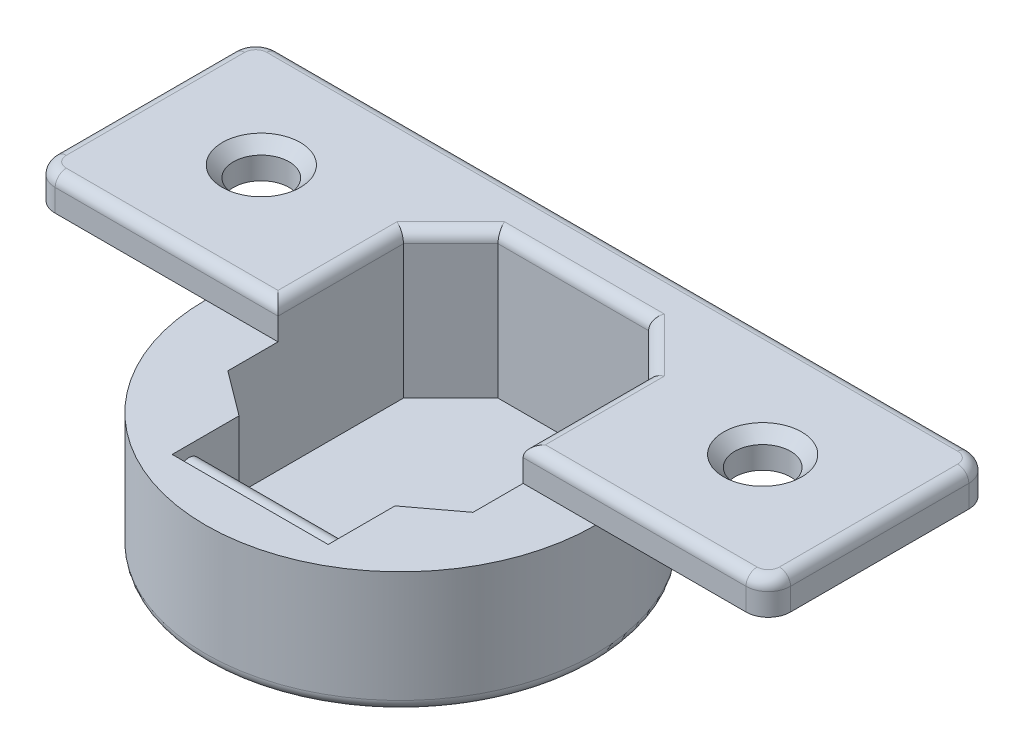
SolidWorks part; units mm, degrees
ref_plane "Vorne" through (0, 0, 0) normal (0, 0, 1) x (1, 0, 0)
ref_plane "Oben" through (0, 0, 0) normal (0, 1, 0) x (1, 0, 0)
ref_plane "Rechts" through (0, 0, 0) normal (1, 0, 0) x (0, 0, -1)
sketch "Skizze1" plane through (0, 0, 0) normal (0, 1, 0) x (1, 0, 0)
  circle A0 centre (0, 0) radius 17.5
  dimension "D1" = 35
extrude "Linear austragen1" add sketch "Skizze1" along normal blind 11
sketch "Skizze2" plane through (0, 11, 0) normal (0, 1, 0) x (1, 0, 0)
  line L1 (31, 20) -> (-31, 20)
  line L2 (33, 18) -> (33, 2)
  line L3 (31, 0) -> (-31, 0)
  line L4 (-33, 18) -> (-33, 2)
  line L5 (33, 20) -> (-33, 0) construction
  line L6 (33, 0) -> (-33, 20) construction
  arc A0 (31, 20) -> (33, 18) centre (31, 18) cw
  arc A1 (33, 2) -> (31, 0) centre (31, 2) cw
  arc A2 (-31, 0) -> (-33, 2) centre (-31, 2) cw
  arc A3 (-31, 20) -> (-33, 18) centre (-31, 18) ccw
  point P0 (0, 10)
  dimension "D3" = 2
  dimension "D1" = 66
  dimension "D2" = 20
extrude "Linear austragen2" add sketch "Skizze2" along normal blind 3
sketch "Skizze3" plane through (0, 14, 0) normal (0, 1, 0) x (1, 0, 0)
  line L0 (0, 25.9125) -> (0, -24.8632) construction
  line L1 (-11, 11.2574) -> (-6.7574, 15.5)
  line L2 (-11, 11.2574) -> (-11, -4.5)
  line L3 (11, 11.2574) -> (11, -4.5)
  line L4 (-11, -4.5) -> (-7, -7.5)
  line L5 (11, -4.5) -> (7, -7.5)
  line L6 (-7, -7.5) -> (-7, -13.5)
  line L7 (7, -7.5) -> (7, -13.5)
  line L8 (-7, -13.5) -> (7, -13.5)
  line L10 (-6.7574, 15.5) -> (0, 15.5)
  line L11 (11, 11.2574) -> (6.7574, 15.5)
  line L12 (6.7574, 15.5) -> (0, 15.5)
  line L13 (31, 20) -> (-31, 20) construction
  arc A1 (-17.5, 0) -> (17.5, 0) centre (0, 0) ccw construction
  point P6 (0, 16)
  point P13 (0, -13.5)
  dimension "D1" = 45
  dimension "D2" = 22
  dimension "D3" = 14
  dimension "D4" = 4
  dimension "D5" = 5
  dimension "D6" = 6
  dimension "D7" = 45
  dimension "D8" = 4.5
  dimension "D9" = 6
extrude "Linear austragen3" cut sketch "Skizze3" against normal blind 13
sketch "Skizze4" plane through (0, 0, 0) normal (1, 0, 0) x (0, 0, -1)
  line L0 (-13.5, 1) -> (-13.5, 11) construction
  line L1 (0, 11) -> (-17.5, 11) construction
  circle A0 centre (-12, 9) radius 1
  circle A1 centre (-8, 5) radius 1
  dimension "D2" = 2
  dimension "D4" = 2
  dimension "D1" = 1.5
  dimension "D3" = 4
  dimension "D5" = 2
  dimension "D6" = 4
extrude "Linear austragen4" add sketch "Skizze4" along normal up to surface and the other way up to surface
fillet "Verrundung1" radius 1 14 edges at (-32.4142, 14, -0.5858) (-33, 14, -10) (-32.4142, 14, -19.4142) (0, 14, -20) (32.4142, 14, -19.4142) (33, 14, -10) (32.4142, 14, -0.5858) (21, 14, 0) (11, 14, -5.6287) (8.8787, 14, -13.3787) (0, 14, -15.5) (-8.8787, 14, -13.3787) (-11, 14, -5.6287) (-21, 14, 0)
fillet "Verrundung2" radius 1 1 edges at (0, 0, 17.5)
sketch "Skizze5" plane through (0, 14, 0) normal (0, 1, 0) x (1, 0, 0)
  line L5 (-11, 0) -> (-31, 0) construction
  line L6 (0, 25.7734) -> (0, -22.5783) construction
  circle A0 centre (-22.5, 10) radius 2.5
  circle A1 centre (22.5, 10) radius 2.5
  dimension "D1" = 5
  dimension "D2" = 5
  dimension "D3" = 45
  dimension "D5" = 10
extrude "Linear austragen5" cut sketch "Skizze5" against normal blind 13
chamfer "Fase1" distance 1 angle 45 2 edges at (22.5, 14, -7.5) (-22.5, 14, -7.5)
